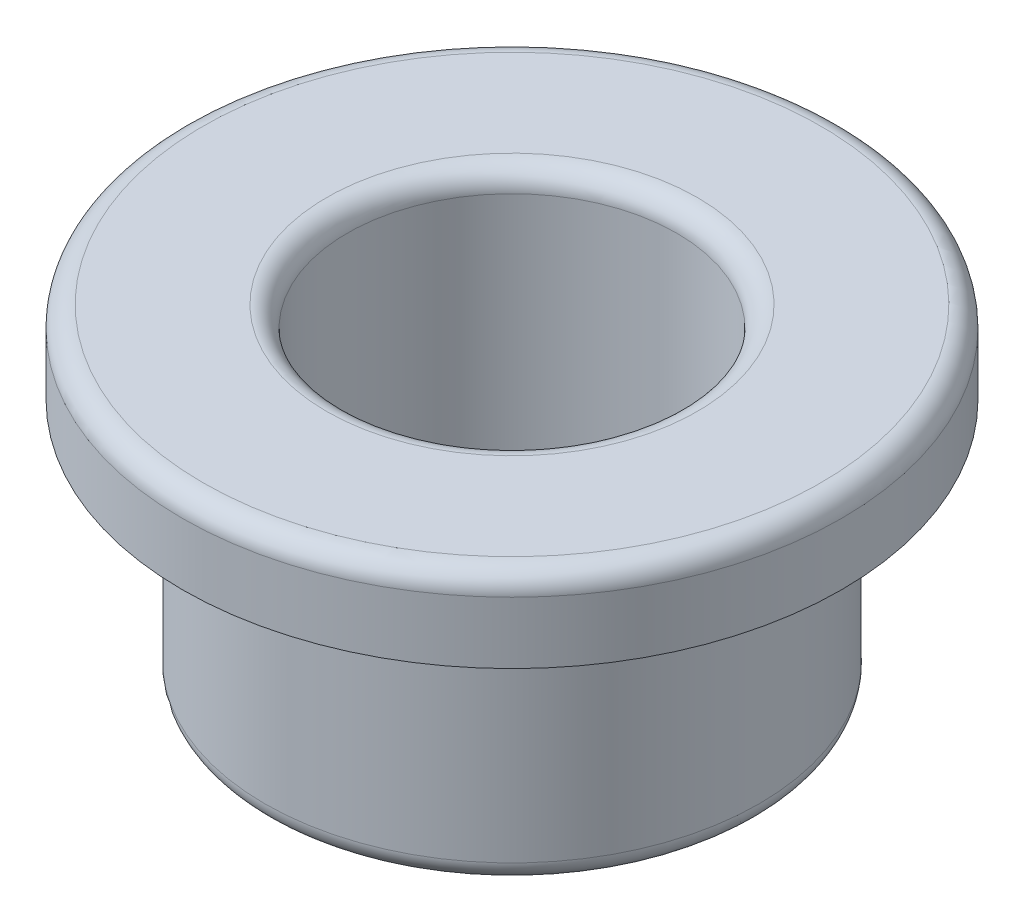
SolidWorks part; units mm, degrees
ref_plane "Face" through (0, 0, 0) normal (0, 0, 1) x (1, 0, 0)
ref_plane "Dessus" through (0, 0, 0) normal (0, 1, 0) x (1, 0, 0)
ref_plane "Droite" through (0, 0, 0) normal (1, 0, 0) x (0, 0, -1)
sketch "Esquisse1" plane through (0, 0, 0) normal (0, 0, 1) x (1, 0, 0)
  line L0 (0, 0) -> (0, 16.9468) construction
  line L1 (4, 0) -> (6, 0)
  line L2 (4, 0) -> (4, 8)
  line L4 (6, 0) -> (6, 6)
  line L5 (6, 6) -> (8, 6)
  line L7 (4, 8) -> (8, 8)
  line L8 (8, 6) -> (8, 8)
  dimension "D1" = 4
  dimension "D2" = 6
  dimension "D3" = 8
  dimension "D4" = 8
  dimension "D5" = 2
revolve "Révolution1" add sketch "Esquisse1" angle 360 about L0
fillet "Congé1" radius 0.5 5 edges at (0, 0, -4) (0, 0, -6) (0, 6, -6) (0, 8, -8) (0, 8, -4)
